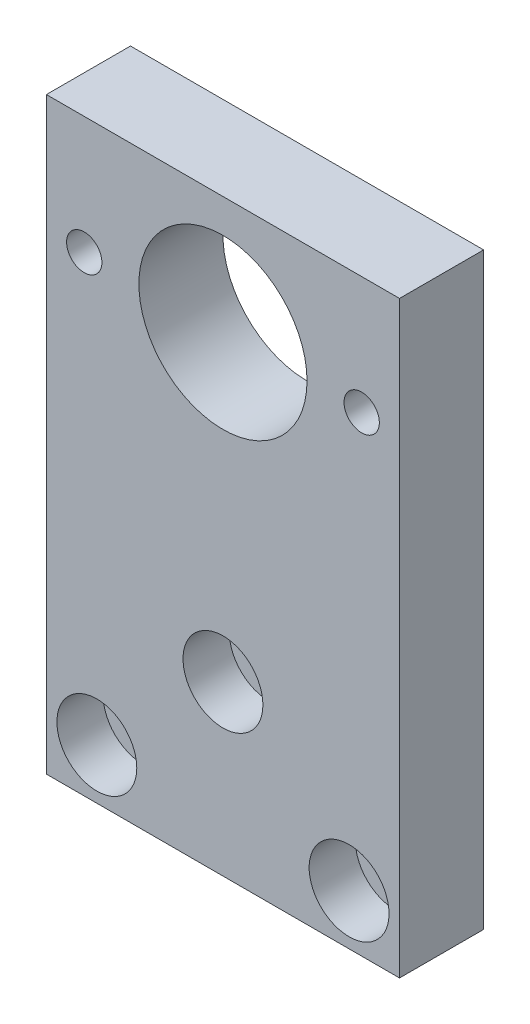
SolidWorks part; units mm, degrees
ref_plane "前视基准面" through (0, 0, 0) normal (0, 0, 1) x (1, 0, 0)
ref_plane "上视基准面" through (0, 0, 0) normal (0, 1, 0) x (1, 0, 0)
ref_plane "右视基准面" through (0, 0, 0) normal (1, 0, 0) x (0, 0, -1)
sketch "草图1" plane through (0, 0, 0) normal (0, 0, 1) x (1, 0, 0)
  line L0 (0, 0) -> (0, 70)
  line L1 (42, 0) -> (42, 70)
  line L2 (0, 70) -> (42, 70)
  line L3 (0, 0) -> (42, 0)
  circle A0 centre (6, 6) radius 2.75
  circle A1 centre (36, 6) radius 2.75
  circle A2 centre (21, 20) radius 2.75
  circle A3 centre (4.5, 56) radius 2.1
  circle A4 centre (37.5, 56) radius 2.1
  circle A5 centre (21, 56) radius 10
extrude "凸台-拉伸1" add sketch "草图1" along normal blind 10
sketch "草图2" plane through (0, 0, 10) normal (0, 0, 1) x (1, 0, 0)
  circle A0 centre (6, 6) radius 4.75
  circle A1 centre (36, 6) radius 4.75
  circle A2 centre (21, 20) radius 4.75
extrude "切除-拉伸1" cut sketch "草图2" against normal blind 5.5
